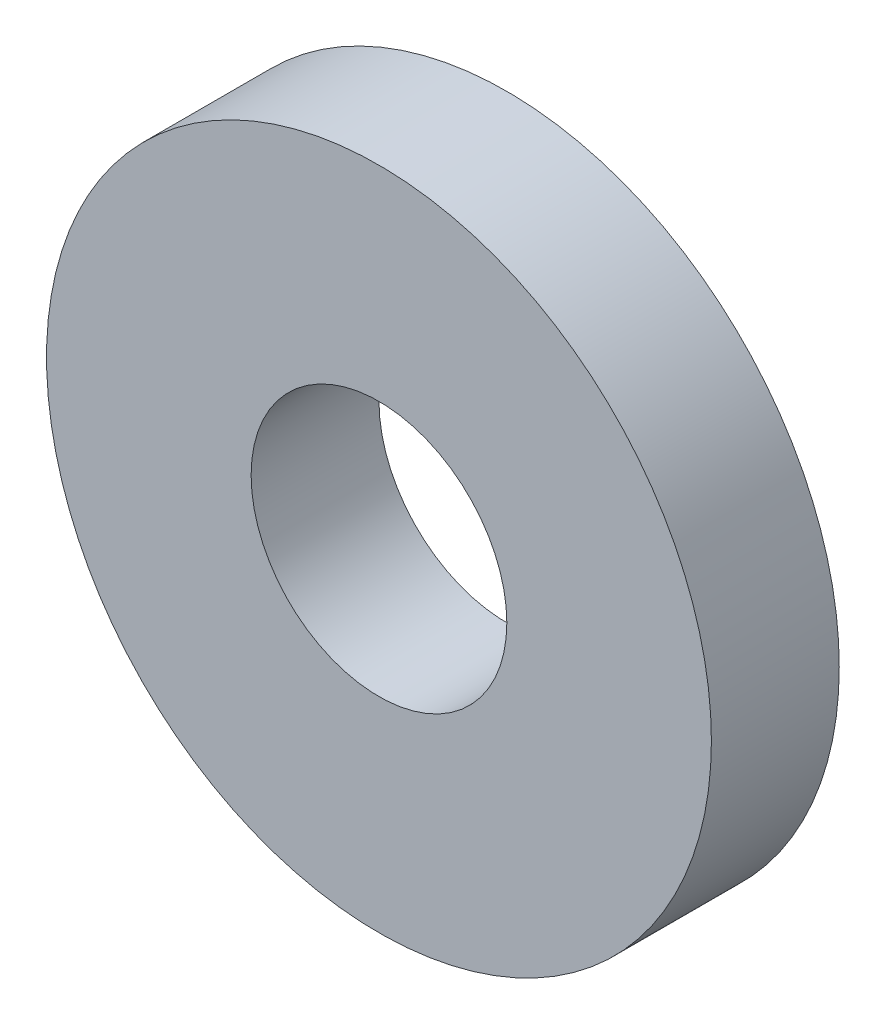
SolidWorks part; units mm, degrees
ref_plane "Plan de face" through (0, 0, 0) normal (0, 0, 1) x (1, 0, 0)
ref_plane "Plan de dessus" through (0, 0, 0) normal (0, 1, 0) x (1, 0, 0)
ref_plane "Plan de droite" through (0, 0, 0) normal (1, 0, 0) x (0, 0, -1)
sketch "Esquisse1" plane through (0, 0, 0) normal (0, 0, 1) x (1, 0, 0)
  circle A0 centre (-54.2785, 4.6476) radius 13
  dimension "D1" = 26
extrude "Boss.-Extru.1" add sketch "Esquisse1" along normal blind 5 contours A0
sketch "Esquisse2" plane through (0, 0, 5) normal (0, 0, 1) x (1, 0, 0)
  circle A0 centre (-54.2785, 4.6476) radius 5
extrude "Enlèv. mat.-Extru.1" cut sketch "Esquisse2" against normal blind 5
